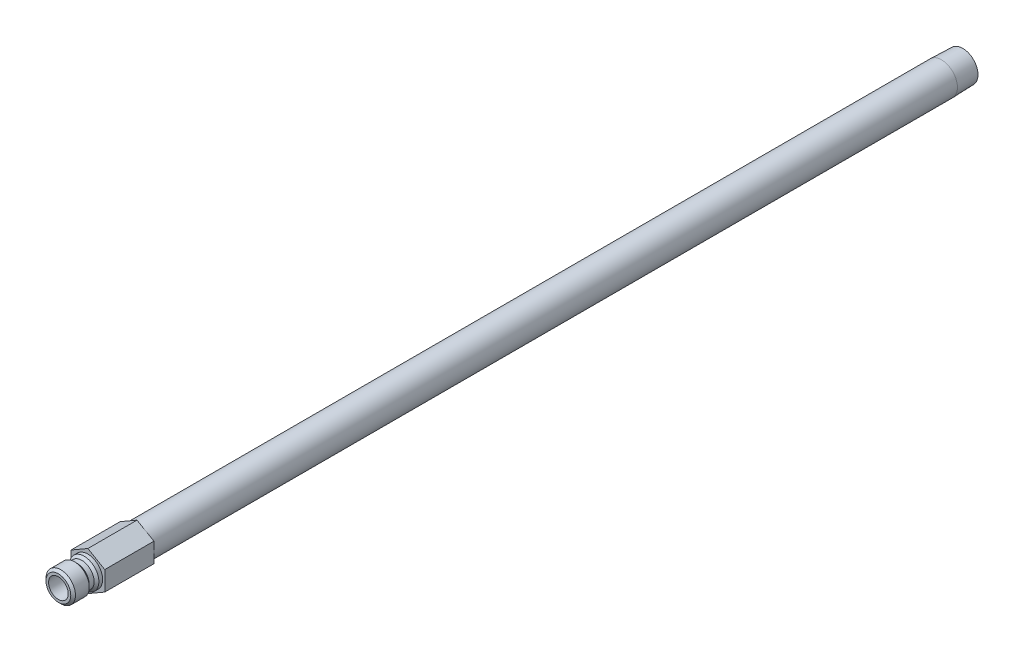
SolidWorks part; units mm, degrees
ref_plane "Front Plane" through (0, 0, 0) normal (0, 0, 1) x (1, 0, 0)
ref_plane "Top Plane" through (0, 0, 0) normal (0, 1, 0) x (1, 0, 0)
ref_plane "Right Plane" through (0, 0, 0) normal (1, 0, 0) x (0, 0, -1)
sketch "Sketch1" plane through (0, 0, 0) normal (1, 0, 0) x (0, 0, -1)
  line L0 (0, 0) -> (-12.7, 0) construction
  line L1 (-9.525, 3.175) -> (-9.525, 4.0005)
  line L2 (-3.556, 4.0005) -> (-3.556, 0) construction
  line L3 (-8.763, 4.7625) -> (-4.318, 4.7625)
  line L4 (0, 5.1435) -> (0, 3.4163) construction
  line L5 (-3.556, 4.0005) -> (-1.9685, 4.0005)
  line L6 (-1.2065, 4.7625) -> (0, 4.7625)
  line L7 (0, 4.7625) -> (0, 5.1435)
  line L8 (-3.556, 4.0005) -> (-4.318, 4.7625)
  line L9 (-1.9685, 4.0005) -> (-1.2065, 4.7625)
  line L10 (-9.525, 4.0005) -> (-8.763, 4.7625)
  line L12 (0, 5.1435) -> (275.717, 5.1435)
  line L13 (275.717, 5.1435) -> (282.575, 4.9292)
  line L14 (282.575, 4.9292) -> (282.575, 2.3813)
  line L15 (0, 0) -> (15.875, 0) construction
  line L16 (15.875, 0) -> (15.875, 4.7625) construction
  line L17 (15.875, 4.7625) -> (0, 4.7625) construction
  line L18 (0.127, 2.3813) -> (282.575, 2.3813)
  line L19 (0.127, 3.175) -> (-9.525, 3.175)
  line L20 (0, 3.175) -> (0, 0) construction
  line L21 (0.127, 2.3813) -> (0.127, 3.175)
  dimension "D1" = 9.525
  dimension "D2" = 1.5875
  dimension "D3" = 0.762
  dimension "D4" = 45
  dimension "D5" = 5.969
  dimension "D6" = 45
  dimension "D7" = 1.79
  dimension "D8" = 6.858
  dimension "D9" = 292.1
  dimension "D10" = 3.175
  dimension "D11" = 25.4
  dimension "D12" = 4.7625
  dimension "D13" = 6.35
  dimension "D14" = 9.525
  dimension "D15" = 10.287
  dimension "D16" = 9.652
revolve "Revolve1" add sketch "Sketch1" angle 360 about L0
sketch "Sketch2" plane through (0, 0, 0) normal (0, 0, 1) x (1, 0, 0)
  line L1 (-5.461, 3.1529) -> (-5.461, -3.1529)
  line L2 (-5.461, -3.1529) -> (0, -6.3058)
  line L3 (0, -6.3058) -> (5.461, -3.1529)
  line L4 (5.461, -3.1529) -> (5.461, 3.1529)
  line L5 (5.461, 3.1529) -> (0, 6.3058)
  line L6 (0, 6.3058) -> (-5.461, 3.1529)
  circle A0 centre (0, 0) radius 5.461 construction
  circle A1 centre (0, 0) radius 2.3812 construction
  circle A2 centre (0, 0) radius 2.3812
  dimension "D1" = 10.922
extrude "Boss-Extrude1" add sketch "Sketch2" against normal up to vertex (15.875 mm away) from vertex at 0
